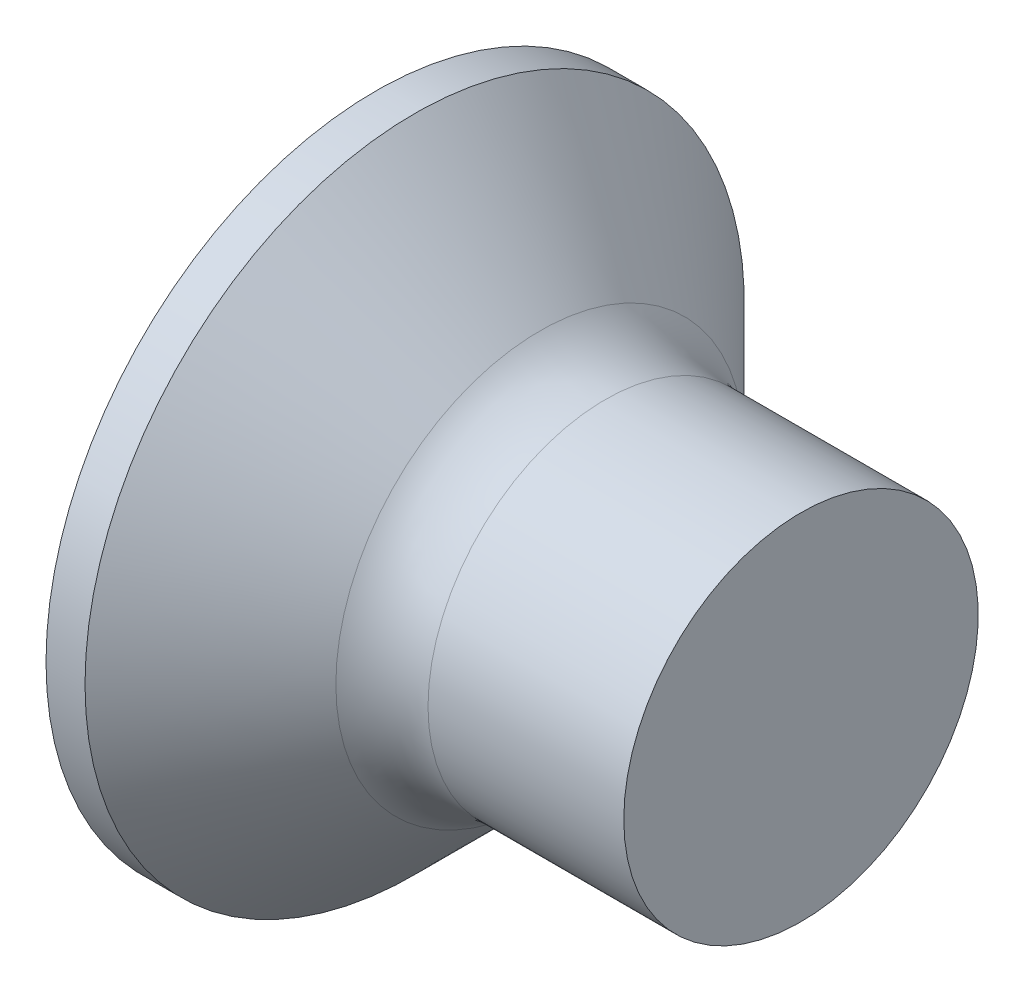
SolidWorks part; units mm, degrees
ref_plane "Plane1" through (0, 0, 0) normal (0, 0, 1) x (1, 0, 0)
ref_plane "Plane2" through (0, 0, 0) normal (0, 1, 0) x (1, 0, 0)
ref_plane "Plane3" through (0, 0, 0) normal (1, 0, 0) x (0, 0, -1)
revolve "Base-Revolve" add sketch "BodySke"
sketch "BodySke" plane through (0, 0, 0) normal (0, 0, 1) x (1, 0, 0)
  line L0 (0, 0) -> (0, 4.65)
  line L1 (0, 4.65) -> (0.55, 4.65)
  line L2 (2.7, 2.5) -> (6, 2.5)
  line L3 (6, 2.5) -> (6, 0)
  line L4 (6, 0) -> (0, 0)
  line L5 (-6.35, 0) -> (82.55, 0) construction
  line L6 (2.7, -2.5) -> (6, -2.5) construction
  line L7 (0.55, -4.65) -> (2.7, -2.5) construction
  line L8 (0.55, 4.65) -> (2.7, 2.5)
  line L9 (0, -4.65) -> (0.55, -4.65) construction
  line L10 (3.5, 4.0875) -> (3.5, -5.4375) construction
  line L11 (0, 6.35) -> (0, -3.175) construction
  dimension "Diameter" = 5
  dimension "Length" = 6
  dimension "Head_ht" = 2.7
  dimension "Head_dia" = 9.3
  dimension "Head_ang" = 90
  dimension "D6" = 0.55
  dimension "Advance" = 0.8
  dimension "Thread_nom" = 6
fillet "Fillet1" radius 1.3 1 edges at (2.7, 0, 2.5)
sketch "Sketch3" plane through (0, 0, 0) normal (-1, 0, 0) x (0, 0, 1)
  line L0 (-0.515, 2.45) -> (0.515, 2.45)
  line L1 (0.515, 2.45) -> (0.515, -2.45)
  line L2 (0.515, -2.45) -> (-0.515, -2.45)
  line L3 (-0.515, -2.45) -> (-0.515, 2.45)
  dimension "D1" = 2.45
  dimension "Cross_dia" = 4.9
  dimension "D2" = 0.515
  dimension "Cross_width" = 1.03
ref_plane "Plane4" through (3.05, 0, 0) normal (-1, 0, 0) x (0, 0, 1)
sketch "Sketch4" plane through (3.05, 0, 0) normal (-1, 0, 0) x (0, 0, 1)
  line L0 (-0.515, 0.9293) -> (0.515, 0.9293)
  line L3 (0.515, 0.9293) -> (0.515, -0.9293)
  line L4 (0.515, -0.9293) -> (-0.515, -0.9293)
  line L5 (-0.515, -0.9293) -> (-0.515, 0.9293)
  dimension "D1" = 1.03
  dimension "D2" = 1.8587
  dimension "D3" = 0.515
  dimension "D4" = 0.9293
loft "Recess" cut profiles "Sketch3", "Sketch4"
pattern_circular "RecPat" count 2 every 90 about axis through (0, 0, 0) along (1, 0, 0) of "Recess"
sketch "RecCorSke" plane through (0, 0, 0) normal (0, 0, 1) x (1, 0, 0)
  line L0 (-3.175, 0) -> (15.875, 0) construction
  line L2 (0, 0) -> (0, 1.0643)
  line L3 (0, 1.0643) -> (3.05, 0.851)
  line L4 (3.05, 0.851) -> (3.3265, 0)
  line L5 (3.3265, 0) -> (0, 0)
  dimension "Diameter" = 1.702
  dimension "Depth" = 3.05
  dimension "Draft_angle" = 4
  dimension "Bottom_angle" = 18
revolve "RecessCore" cut sketch "RecCorSke" angle 360 about L0
sketch "ThdSchSke" plane through (0, 0, 0) normal (0, 0, 1) x (1, 0, 0)
  line L0 (3.5, -2.055) -> (3.1884, -2.5)
  line L1 (3.5, -2.055) -> (3.8116, -2.5)
  line L2 (3.8116, -2.5) -> (3.8116, -3.125)
  line L3 (-3.175, 0) -> (5.1513, 0) construction
  line L5 (3.8116, -3.125) -> (3.1884, -3.125)
  line L6 (3.1884, -3.125) -> (3.1884, -2.5)
  line L7 (0, 4.65) -> (0, -4.65) construction
  dimension "Thread_minor" = 4.11
  dimension "Diameter" = 5
  dimension "Start" = 3.5
  dimension "SideAngle" = 55
  dimension "VeeAngle" = 70
  dimension "Overcut" = 6.25
revolve "ThreadSchematic" [suppressed] cut sketch "ThdSchSke" angle 360 about L3
pattern_linear "ThdSchPat" [suppressed]
equation "\"D1@Sketch3\" = \"Cross_dia@Sketch3\" / 2"
equation "\"D2@Sketch3\" = \"Cross_width@Sketch3\" / 2"
equation "\"Depth@RecCorSke\" = \"Cross_depth@Plane4\""
equation "\"D1@Sketch4\" = \"Cross_width@Sketch3\""
equation "\"D2@Sketch4\" = \"Cross_dia@Sketch3\" - 2.0 * \"Cross_depth@Plane4\" * tan(26.5  * 0.017453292)"
equation "\"D3@Sketch4\" = \"D1@Sketch4\" / 2"
equation "\"D4@Sketch4\" = \"D2@Sketch4\" / 2"
equation "\"Thread_length@ThreadCosmetic\" = ((sgn( (\"Length@BodySke\" - \"Advance@BodySke\" * 1.0 - \"Head_ht@BodySke\" ) - \"Thread_nom@BodySke\" )-1)*( (\"Length@BodySke\" - \"Advance@BodySke\" * 1.0 - \"Head_ht@BodySke\" "
equation "\"Thread_minor@ThdSchSke\" = \"Thread_minor@ThreadCosmetic\""
equation "\"Diameter@ThdSchSke\" = \"Diameter@BodySke\""
equation "\"Overcut@ThdSchSke\" = \"Diameter@BodySke\" * 1.25"
equation "\"Start@ThdSchSke\" = 0.000001 + \"Length@BodySke\" - \"Thread_length@ThreadCosmetic\"  '---Countersunk---"
equation "\"Num_threads@ThdSchPat\" = int( \"Thread_length@ThreadCosmetic\" / \"Advance@BodySke\" + 0.999 )  + 1"
equation "\"Advance@ThdSchPat\" = \"Thread_length@ThreadCosmetic\" /  (\"Num_threads@ThdSchPat\" - 1) 'relax it"
